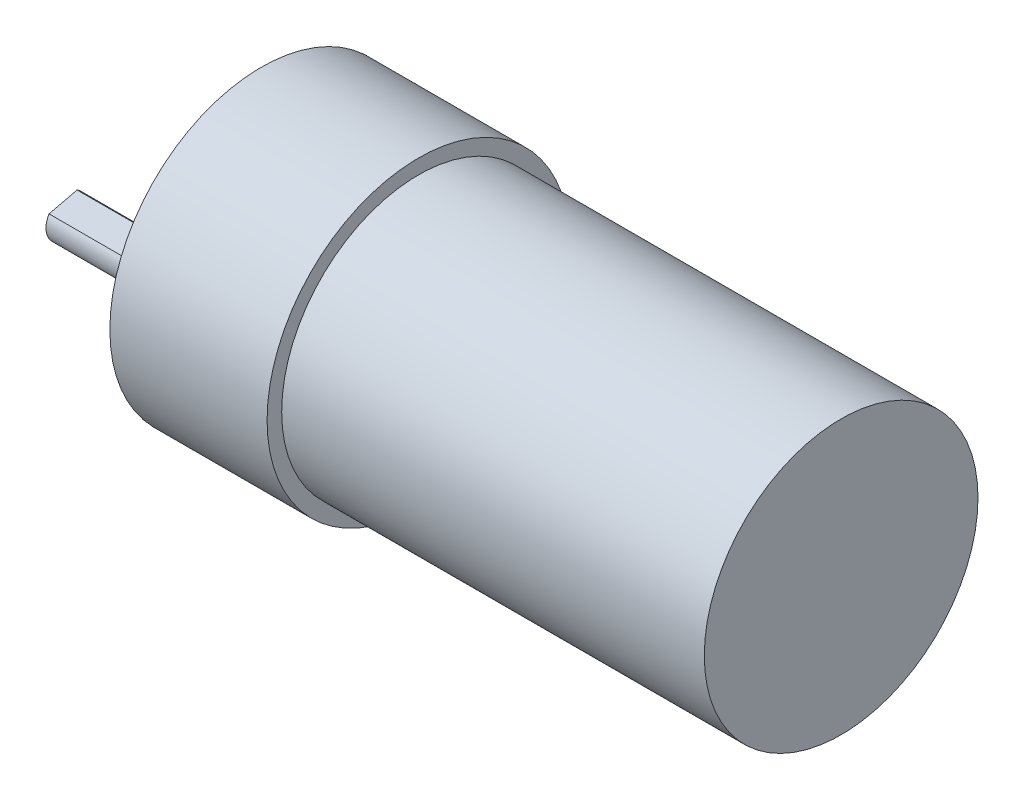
SolidWorks part; units mm, degrees
ref_plane "Front Plane" through (0, 0, 0) normal (0, 0, 1) x (1, 0, 0)
ref_plane "Top Plane" through (0, 0, 0) normal (0, 1, 0) x (1, 0, 0)
ref_plane "Right Plane" through (0, 0, 0) normal (1, 0, 0) x (0, 0, -1)
sketch "Sketch1" plane through (0, 0, 0) normal (1, 0, 0) x (0, 0, -1)
  circle A0 centre (0, 0) radius 15.875
  dimension "D1" = 31.75
extrude "Extrude1" add sketch "Sketch1" along normal blind 49.022
sketch "Sketch3" plane through (0, 0, 0) normal (-1, 0, 0) x (0, 0, 1)
  circle A0 centre (0, 0) radius 17.5692
extrude "Extrude3" add sketch "Sketch3" along normal blind 18.2372
sketch "Sketch4" plane through (-18.2372, 0, 0) normal (-1, 0, 0) x (0, 0, 1)
  line L0 (0, 0) -> (0, -8.7186) construction
  circle A0 centre (0, -8.7186) radius 2.3749
  dimension "D2" = 4.7498
  dimension "D1" = 8.7186
extrude "Extrude4" add sketch "Sketch4" along normal blind 22.606
sketch "Sketch5" plane through (-18.2372, 0, 0) normal (-1, 0, 0) x (0, 0, 1)
  line L0 (0, 17.5692) -> (0, 13.4556) construction
  circle A0 centre (0, 0) radius 17.5692 construction
  circle A1 centre (0, 13.4556) radius 1.27
  circle A3 centre (0, -8.7186) radius 2.3749 construction
  dimension "D2" = 2.54
  dimension "D1" = 22.1742
extrude "Cut-Extrude1" cut sketch "Sketch5" against normal blind 10
sketch "Sketch6" plane through (-18.2372, 0, 0) normal (-1, 0, 0) x (0, 0, 1)
  line L0 (0, -8.7186) -> (10.2108, -8.7186) construction
  line L1 (0, -8.7186) -> (-10.2108, -8.7186) construction
  circle A0 centre (10.2108, -8.7186) radius 1.27
  circle A4 centre (0, 13.4556) radius 1.27 construction
  circle A5 centre (-10.2108, -8.7186) radius 1.27
  circle A6 centre (0, 13.4556) radius 1.27 construction
  dimension "D1" = 10.2108
extrude "Cut-Extrude2" cut sketch "Sketch6" against normal blind 10
sketch3d "3DSketch3"
  circle A0 centre (-18.2372, -8.7186, 10.2108) radius 1.27 construction
  point P2 (-19.5072, -8.7186, 10.2108)
sketch "Sketch7" plane through (0, -5.9371, -1.4198) normal (0, 0.9726, 0.2326) x (-1, 0, 0)
  line L0 (25.8572, 1.8493) -> (18.2372, 1.8493) construction
  line L1 (25.8572, 6.9456) -> (43.5843, 6.9456)
  line L2 (25.8572, 6.9456) -> (25.8572, -4.0683)
  line L3 (25.8572, -4.0683) -> (43.5843, -4.0683)
  line L4 (43.5843, 6.9456) -> (43.5843, -4.0683)
  line L5 (18.2372, -0.3471) -> (18.2372, 4.4027) construction
  dimension "D1" = 7.62
extrude "Cut-Extrude3" cut sketch "Sketch7" against normal blind 0.6858
sketch "Sketch9" plane through (0, 0, 0) normal (1, 0, 0) x (0, 0, -1)
  line L0 (0, 0) -> (0, 15.875)
  circle A0 centre (0, 0) radius 15.875 construction
ref_plane "Plane3" through (0, 15.875, 0) normal (0, 1, 0) x (-1, 0, 0)
